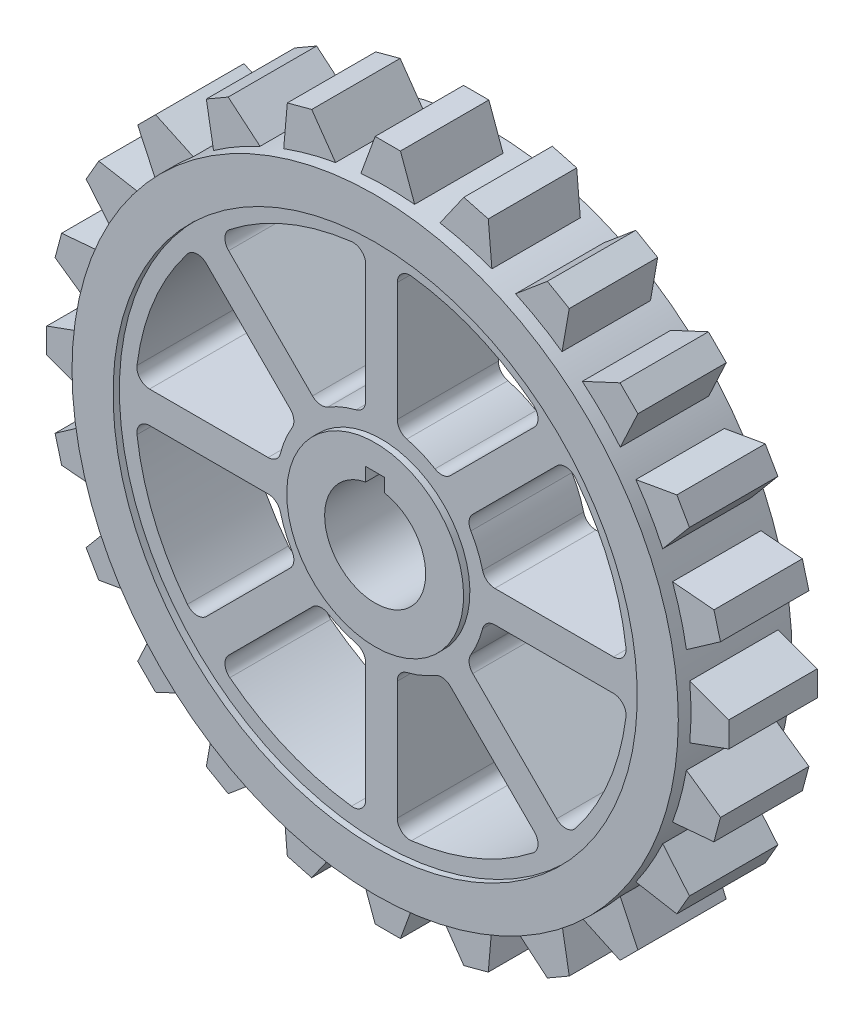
SolidWorks part; units mm, degrees
ref_plane "Front Plane" through (0, 0, 0) normal (0, 0, 1) x (1, 0, 0)
ref_plane "Top Plane" through (0, 0, 0) normal (0, 1, 0) x (1, 0, 0)
ref_plane "Right Plane" through (0, 0, 0) normal (1, 0, 0) x (0, 0, -1)
sketch "Sketch1" plane through (0, 0, 0) normal (1, 0, 0) x (0, 0, -1)
  line L0 (-9, 0) -> (9, 0) construction
  line L1 (-9, 8) -> (9, 8)
  line L2 (9, 8) -> (9, 14)
  line L3 (9, 14) -> (8, 14)
  line L4 (8, 14) -> (8, 41.5)
  line L5 (8, 41.5) -> (9, 41.5)
  line L6 (9, 41.5) -> (9, 48)
  line L7 (9, 48) -> (7, 48)
  line L8 (7, 48) -> (7, 54)
  line L9 (7, 54) -> (-7, 54)
  line L10 (-7, 54) -> (-7, 48)
  line L11 (-7, 48) -> (-9, 48)
  line L12 (-9, 48) -> (-9, 41.5)
  line L13 (-9, 41.5) -> (-8, 41.5)
  line L14 (-8, 41.5) -> (-8, 14)
  line L15 (-8, 14) -> (-9, 14)
  line L16 (-9, 14) -> (-9, 8)
  line L17 (-9, 8) -> (-9, -8) construction
  line L18 (9, 8) -> (9, -8) construction
  line L19 (-9, -14) -> (-9, -8)
  line L20 (-8, -14) -> (-9, -14)
  line L21 (-8, -41.5) -> (-8, -14)
  line L22 (-9, -41.5) -> (-8, -41.5)
  line L23 (-9, -48) -> (-9, -41.5)
  line L24 (-7, -48) -> (-9, -48)
  line L25 (-7, -54) -> (-7, -48)
  line L26 (7, -54) -> (-7, -54)
  line L27 (7, -48) -> (7, -54)
  line L28 (9, -48) -> (7, -48)
  line L29 (9, -41.5) -> (9, -48)
  line L30 (8, -41.5) -> (9, -41.5)
  line L31 (8, -14) -> (8, -41.5)
  line L32 (9, -14) -> (8, -14)
  line L33 (9, -8) -> (9, -14)
  line L34 (-9, -8) -> (9, -8)
  line L35 (7, 54) -> (7, 55)
  line L36 (7, 55) -> (-7, 55)
  line L37 (-7, 55) -> (-7, 54)
  point P4 (0, 0)
revolve "Revolve1" add sketch "Sketch1" angle 360 about L0
sketch "Sketch2" plane through (0, 0, 9) normal (0, 0, 1) x (1, 0, 0)
  line L0 (-1.5, 7.8581) -> (-1.5, 10)
  line L1 (-1.5, 10) -> (1.5, 10)
  line L2 (1.5, 10) -> (1.5, 7.8581)
  line L3 (0, 0) -> (0, 10) construction
  line L4 (0, 0) -> (46.0202, 46.0202) construction
  line L5 (2.5, 36.7253) -> (2.5, 17.9444)
  line L7 (10.9208, 14.4563) -> (24.201, 27.7365)
  line L8 (27.7365, 24.201) -> (14.4563, 10.9208)
  line L9 (17.9444, 2.5) -> (36.7253, 2.5)
  line L10 (36.7253, -2.5) -> (17.9444, -2.5)
  line L11 (14.4563, -10.9208) -> (27.7365, -24.201)
  line L12 (24.201, -27.7365) -> (10.9208, -14.4563)
  line L13 (2.5, -17.9444) -> (2.5, -36.7253)
  line L14 (-2.5, -36.7253) -> (-2.5, -17.9444)
  line L15 (-10.9208, -14.4563) -> (-24.201, -27.7365)
  line L16 (-27.7365, -24.201) -> (-14.4563, -10.9208)
  line L17 (-17.9444, -2.5) -> (-36.7253, -2.5)
  line L18 (-36.7253, 2.5) -> (-17.9444, 2.5)
  line L19 (-14.4563, 10.9208) -> (-27.7365, 24.201)
  line L20 (-24.201, 27.7365) -> (-10.9208, 14.4563)
  line L21 (-2.5, 17.9444) -> (-2.5, 36.7253)
  line L22 (-1.5, 7.8581) -> (1.5, 7.8581)
  line L23 (-2, 54) -> (2, 54)
  line L24 (2, 54) -> (4.2525, 47.8113)
  line L25 (-2, 54) -> (-4.2525, 47.8113)
  line L26 (12.0444, 52.6776) -> (15.9081, 51.6424)
  line L27 (12.0444, 52.6776) -> (8.2668, 47.2828)
  line L28 (15.9081, 51.6424) -> (16.4821, 45.0815)
  line L29 (25.2679, 47.7654) -> (28.7321, 45.7654)
  line L30 (25.2679, 47.7654) -> (20.2228, 43.532)
  line L31 (28.7321, 45.7654) -> (27.5884, 39.2795)
  line L32 (36.7696, 39.598) -> (39.598, 36.7696)
  line L33 (36.7696, 39.598) -> (30.8007, 36.8146)
  line L34 (39.598, 36.7696) -> (36.8146, 30.8007)
  line L35 (45.7654, 28.7321) -> (47.7654, 25.2679)
  line L36 (45.7654, 28.7321) -> (39.2795, 27.5884)
  line L37 (47.7654, 25.2679) -> (43.532, 20.2228)
  line L38 (51.6424, 15.9081) -> (52.6776, 12.0444)
  line L39 (51.6424, 15.9081) -> (45.0815, 16.4821)
  line L40 (52.6776, 12.0444) -> (47.2828, 8.2668)
  line L41 (54, 2) -> (54, -2)
  line L42 (54, 2) -> (47.8113, 4.2525)
  line L43 (54, -2) -> (47.8113, -4.2525)
  line L44 (52.6776, -12.0444) -> (51.6424, -15.9081)
  line L45 (52.6776, -12.0444) -> (47.2828, -8.2668)
  line L46 (51.6424, -15.9081) -> (45.0815, -16.4821)
  line L47 (47.7654, -25.2679) -> (45.7654, -28.7321)
  line L48 (47.7654, -25.2679) -> (43.532, -20.2228)
  line L49 (45.7654, -28.7321) -> (39.2795, -27.5884)
  line L50 (39.598, -36.7696) -> (36.7696, -39.598)
  line L51 (39.598, -36.7696) -> (36.8146, -30.8007)
  line L52 (36.7696, -39.598) -> (30.8007, -36.8146)
  line L53 (28.7321, -45.7654) -> (25.2679, -47.7654)
  line L54 (28.7321, -45.7654) -> (27.5884, -39.2795)
  line L55 (25.2679, -47.7654) -> (20.2228, -43.532)
  line L56 (15.9081, -51.6424) -> (12.0444, -52.6776)
  line L57 (15.9081, -51.6424) -> (16.4821, -45.0815)
  line L58 (12.0444, -52.6776) -> (8.2668, -47.2828)
  line L59 (2, -54) -> (-2, -54)
  line L60 (2, -54) -> (4.2525, -47.8113)
  line L61 (-2, -54) -> (-4.2525, -47.8113)
  line L62 (-12.0444, -52.6776) -> (-15.9081, -51.6424)
  line L63 (-12.0444, -52.6776) -> (-8.2668, -47.2828)
  line L64 (-15.9081, -51.6424) -> (-16.4821, -45.0815)
  line L65 (-25.2679, -47.7654) -> (-28.7321, -45.7654)
  line L66 (-25.2679, -47.7654) -> (-20.2228, -43.532)
  line L67 (-28.7321, -45.7654) -> (-27.5884, -39.2795)
  line L68 (-36.7696, -39.598) -> (-39.598, -36.7696)
  line L69 (-36.7696, -39.598) -> (-30.8007, -36.8146)
  line L70 (-39.598, -36.7696) -> (-36.8146, -30.8007)
  line L71 (-45.7654, -28.7321) -> (-47.7654, -25.2679)
  line L72 (-45.7654, -28.7321) -> (-39.2795, -27.5884)
  line L73 (-47.7654, -25.2679) -> (-43.532, -20.2228)
  line L74 (-51.6424, -15.9081) -> (-52.6776, -12.0444)
  line L75 (-51.6424, -15.9081) -> (-45.0815, -16.4821)
  line L76 (-52.6776, -12.0444) -> (-47.2828, -8.2668)
  line L77 (-54, -2) -> (-54, 2)
  line L78 (-54, -2) -> (-47.8113, -4.2525)
  line L79 (-54, 2) -> (-47.8113, 4.2525)
  line L80 (-52.6776, 12.0444) -> (-51.6424, 15.9081)
  line L81 (-52.6776, 12.0444) -> (-47.2828, 8.2668)
  line L82 (-51.6424, 15.9081) -> (-45.0815, 16.4821)
  line L83 (-47.7654, 25.2679) -> (-45.7654, 28.7321)
  line L84 (-47.7654, 25.2679) -> (-43.532, 20.2228)
  line L85 (-45.7654, 28.7321) -> (-39.2795, 27.5884)
  line L86 (-39.598, 36.7696) -> (-36.7696, 39.598)
  line L87 (-39.598, 36.7696) -> (-36.8146, 30.8007)
  line L88 (-36.7696, 39.598) -> (-30.8007, 36.8146)
  line L89 (-28.7321, 45.7654) -> (-25.2679, 47.7654)
  line L90 (-28.7321, 45.7654) -> (-27.5884, 39.2795)
  line L91 (-25.2679, 47.7654) -> (-20.2228, 43.532)
  line L92 (-15.9081, 51.6424) -> (-12.0444, 52.6776)
  line L93 (-15.9081, 51.6424) -> (-16.4821, 45.0815)
  line L94 (-12.0444, 52.6776) -> (-8.2668, 47.2828)
  circle A0 centre (0, 0) radius 8 construction
  circle A1 centre (0, 0) radius 8 construction
  arc A4 (24.0185, 30.7264) -> (4.7432, 38.7105) centre (0, 0) ccw
  arc A6 (8.4789, 14.1548) -> (4.0135, 16.0044) centre (0, 0) ccw
  arc A7 (4.7432, 38.7105) -> (2.5, 36.7253) centre (4.5, 36.7253) ccw
  arc A8 (2.5, 17.9444) -> (4.0135, 16.0044) centre (4.5, 17.9444) ccw
  arc A9 (8.4789, 14.1548) -> (10.9208, 14.4563) centre (9.5066, 15.8706) ccw
  arc A10 (24.201, 27.7365) -> (24.0185, 30.7264) centre (22.7868, 29.1507) ccw
  arc A11 (14.4563, 10.9208) -> (14.1548, 8.4789) centre (15.8706, 9.5066) ccw
  arc A12 (30.7264, 24.0185) -> (27.7365, 24.201) centre (29.1507, 22.7868) ccw
  arc A13 (16.0044, 4.0135) -> (14.1548, 8.4789) centre (0, 0) ccw
  arc A14 (16.0044, 4.0135) -> (17.9444, 2.5) centre (17.9444, 4.5) ccw
  arc A15 (36.7253, 2.5) -> (38.7105, 4.7432) centre (36.7253, 4.5) ccw
  arc A16 (38.7105, 4.7432) -> (30.7264, 24.0185) centre (0, 0) ccw
  arc A17 (17.9444, -2.5) -> (16.0044, -4.0135) centre (17.9444, -4.5) ccw
  arc A18 (38.7105, -4.7432) -> (36.7253, -2.5) centre (36.7253, -4.5) ccw
  arc A19 (14.1548, -8.4789) -> (16.0044, -4.0135) centre (0, 0) ccw
  arc A20 (14.1548, -8.4789) -> (14.4563, -10.9208) centre (15.8706, -9.5066) ccw
  arc A21 (27.7365, -24.201) -> (30.7264, -24.0185) centre (29.1507, -22.7868) ccw
  arc A22 (30.7264, -24.0185) -> (38.7105, -4.7432) centre (0, 0) ccw
  arc A23 (10.9208, -14.4563) -> (8.4789, -14.1548) centre (9.5066, -15.8706) ccw
  arc A24 (24.0185, -30.7264) -> (24.201, -27.7365) centre (22.7868, -29.1507) ccw
  arc A25 (4.0135, -16.0044) -> (8.4789, -14.1548) centre (0, 0) ccw
  arc A26 (4.0135, -16.0044) -> (2.5, -17.9444) centre (4.5, -17.9444) ccw
  arc A27 (2.5, -36.7253) -> (4.7432, -38.7105) centre (4.5, -36.7253) ccw
  arc A28 (4.7432, -38.7105) -> (24.0185, -30.7264) centre (0, 0) ccw
  arc A29 (-2.5, -17.9444) -> (-4.0135, -16.0044) centre (-4.5, -17.9444) ccw
  arc A30 (-4.7432, -38.7105) -> (-2.5, -36.7253) centre (-4.5, -36.7253) ccw
  arc A31 (-8.4789, -14.1548) -> (-4.0135, -16.0044) centre (0, 0) ccw
  arc A32 (-8.4789, -14.1548) -> (-10.9208, -14.4563) centre (-9.5066, -15.8706) ccw
  arc A33 (-24.201, -27.7365) -> (-24.0185, -30.7264) centre (-22.7868, -29.1507) ccw
  arc A34 (-24.0185, -30.7264) -> (-4.7432, -38.7105) centre (0, 0) ccw
  arc A35 (-14.4563, -10.9208) -> (-14.1548, -8.4789) centre (-15.8706, -9.5066) ccw
  arc A36 (-30.7264, -24.0185) -> (-27.7365, -24.201) centre (-29.1507, -22.7868) ccw
  arc A37 (-16.0044, -4.0135) -> (-14.1548, -8.4789) centre (0, 0) ccw
  arc A38 (-16.0044, -4.0135) -> (-17.9444, -2.5) centre (-17.9444, -4.5) ccw
  arc A39 (-36.7253, -2.5) -> (-38.7105, -4.7432) centre (-36.7253, -4.5) ccw
  arc A40 (-38.7105, -4.7432) -> (-30.7264, -24.0185) centre (0, 0) ccw
  arc A41 (-17.9444, 2.5) -> (-16.0044, 4.0135) centre (-17.9444, 4.5) ccw
  arc A42 (-38.7105, 4.7432) -> (-36.7253, 2.5) centre (-36.7253, 4.5) ccw
  arc A43 (-14.1548, 8.4789) -> (-16.0044, 4.0135) centre (0, 0) ccw
  arc A44 (-14.1548, 8.4789) -> (-14.4563, 10.9208) centre (-15.8706, 9.5066) ccw
  arc A45 (-27.7365, 24.201) -> (-30.7264, 24.0185) centre (-29.1507, 22.7868) ccw
  arc A46 (-30.7264, 24.0185) -> (-38.7105, 4.7432) centre (0, 0) ccw
  arc A47 (-10.9208, 14.4563) -> (-8.4789, 14.1548) centre (-9.5066, 15.8706) ccw
  arc A48 (-24.0185, 30.7264) -> (-24.201, 27.7365) centre (-22.7868, 29.1507) ccw
  arc A49 (-4.0135, 16.0044) -> (-8.4789, 14.1548) centre (0, 0) ccw
  arc A50 (-4.0135, 16.0044) -> (-2.5, 17.9444) centre (-4.5, 17.9444) ccw
  arc A51 (-2.5, 36.7253) -> (-4.7432, 38.7105) centre (-4.5, 36.7253) ccw
  arc A52 (-4.7432, 38.7105) -> (-24.0185, 30.7264) centre (0, 0) ccw
  circle A55 centre (0, 0) radius 14 construction
  circle A56 centre (0, 0) radius 14 construction
  circle A57 centre (0, 0) radius 55 construction
  circle A58 centre (0, 0) radius 55
  circle A59 centre (0, 0) radius 48 construction
  arc A60 (-36.8146, 30.8007) -> (-39.2795, 27.5884) centre (0, 0) ccw
  circle A61 centre (0, 0) radius 41.5 construction
  arc A62 (-27.5884, 39.2795) -> (-30.8007, 36.8146) centre (0, 0) ccw
  arc A63 (-16.4821, 45.0815) -> (-20.2228, 43.532) centre (0, 0) ccw
  arc A64 (-4.2525, 47.8113) -> (-8.2668, 47.2828) centre (0, 0) ccw
  arc A65 (8.2668, 47.2828) -> (4.2525, 47.8113) centre (0, 0) ccw
  arc A66 (20.2228, 43.532) -> (16.4821, 45.0815) centre (0, 0) ccw
  arc A67 (30.8007, 36.8146) -> (27.5884, 39.2795) centre (0, 0) ccw
  arc A68 (39.2795, 27.5884) -> (36.8146, 30.8007) centre (0, 0) ccw
  arc A69 (45.0815, 16.4821) -> (43.532, 20.2228) centre (0, 0) ccw
  arc A70 (47.8113, 4.2525) -> (47.2828, 8.2668) centre (0, 0) ccw
  arc A71 (47.2828, -8.2668) -> (47.8113, -4.2525) centre (0, 0) ccw
  arc A72 (43.532, -20.2228) -> (45.0815, -16.4821) centre (0, 0) ccw
  arc A73 (36.8146, -30.8007) -> (39.2795, -27.5884) centre (0, 0) ccw
  arc A74 (27.5884, -39.2795) -> (30.8007, -36.8146) centre (0, 0) ccw
  arc A75 (16.4821, -45.0815) -> (20.2228, -43.532) centre (0, 0) ccw
  arc A76 (4.2525, -47.8113) -> (8.2668, -47.2828) centre (0, 0) ccw
  arc A77 (-8.2668, -47.2828) -> (-4.2525, -47.8113) centre (0, 0) ccw
  arc A78 (-20.2228, -43.532) -> (-16.4821, -45.0815) centre (0, 0) ccw
  arc A79 (-30.8007, -36.8146) -> (-27.5884, -39.2795) centre (0, 0) ccw
  arc A80 (-39.2795, -27.5884) -> (-36.8146, -30.8007) centre (0, 0) ccw
  arc A81 (-45.0815, -16.4821) -> (-43.532, -20.2228) centre (0, 0) ccw
  arc A82 (-47.8113, -4.2525) -> (-47.2828, -8.2668) centre (0, 0) ccw
  arc A83 (-47.2828, 8.2668) -> (-47.8113, 4.2525) centre (0, 0) ccw
  arc A84 (-43.532, 20.2228) -> (-45.0815, 16.4821) centre (0, 0) ccw
  point P114 (0, 0)
  point P117 (0, 54)
  point P216 (0, 0)
extrude "Cut-Extrude1" cut sketch "Sketch2" against normal through all contours A58 A84 L84 L83 L85 A60 L87 L86 L88 A62 L90 L89 L91 A63 L93 L92 L94 A64 L25 L23 L24 A65 L27 L26 L28 A66 L30 L29 L31 A67 L33 L32 L34 A68 L36 L35 L37 A69 L39 L38 L40 A70 L42 L41 L43 A71 L45 L44 L46 A72 | L0 L22 L2 L1 | A51 A52 A48 L20 A47 A49 A50 L21 | L7 A10 A4 A7 L5 A8 A6 A9 | A15 A16 A12 L8 A11 A13 A14 L9 | A21 A22 A18 L10 A17 A19 A20 L11 | A27 A28 A24 L12 A23 A25 A26 L13 | A33 A34 A30 L14 A29 A31 A32 L15 | A39 A40 A36 L16 A35 A37 A38 L17 | A45 A46 A42 L18 A41 A43 A44 L19
equation "\"A\"= 108"
equation "\"B\"= 24"
equation "\"C\"= 2.5"
equation "\"D4@Sketch1\"=\"A\""
equation "\"D5@Sketch2\"=\"C\""
equation "\"D6@Sketch2\"=\"C\""
equation "\"D8@Sketch2\"=\"C\""
equation "\"D12@Sketch2\"=\"C\""
